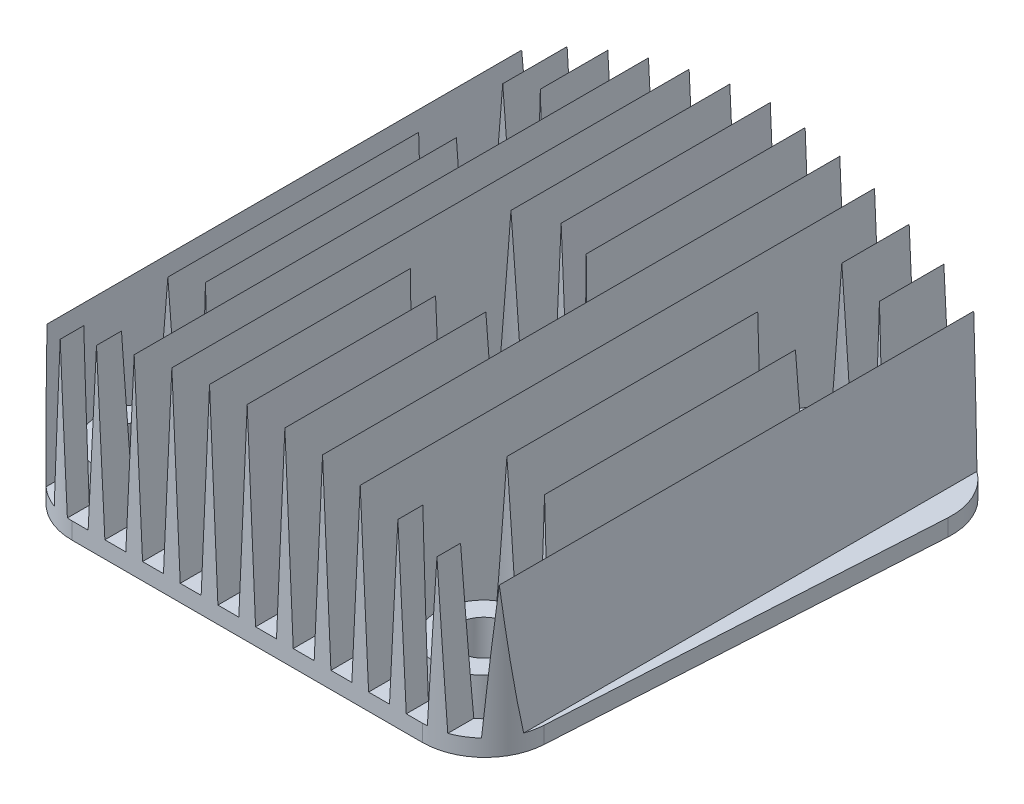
SolidWorks part; units mm, degrees
ref_plane "Front Plane" through (0, 0, 0) normal (0, 0, 1) x (1, 0, 0)
ref_plane "Top Plane" through (0, 0, 0) normal (0, 1, 0) x (1, 0, 0)
ref_plane "Right Plane" through (0, 0, 0) normal (1, 0, 0) x (0, 0, -1)
sketch "Sketch1" plane through (0, 0, 0) normal (0, 1, 0) x (1, 0, 0)
  line L0 (-56, -60) -> (56, -60)
  line L1 (56, -60) -> (63, 60)
  line L2 (63, 60) -> (0, 65)
  line L3 (0, 65) -> (-63, 60)
  line L4 (-63, 60) -> (-56, -60)
  line L5 (0, -60) -> (0, 65) construction
  dimension "D1" = 112
  dimension "D2" = 60
  dimension "D3" = 126
  dimension "D4" = 125
  dimension "D5" = 60
extrude "Boss-Extrude1" add sketch "Sketch1" along normal blind 4
fillet "Fillet1" radius 15 5 edges at (-63, 2, -60) (0, 2, -65) (63, 2, -60) (-56, 2, 60) (56, 2, 60)
sketch "Sketch2" plane through (0, 0, 0) normal (0, -1, 0) x (1, 0, 0)
  circle A0 centre (0, 0) radius 27.5
  dimension "D1" = 55
extrude "Boss-Extrude2" add sketch "Sketch2" along normal blind 4
sketch "Sketch3" plane through (0, 0, 0) normal (0, 0, 1) x (1, 0, 0)
  line L0 (0, 10.5114) -> (0, -9.5692) construction
  line L1 (0, 1.7356) -> (0, -4)
  line L2 (0, -4) -> (22.5, -4)
  line L3 (-27.5, -4) -> (27.5, -4) construction
  arc A0 (0, 1.7356) -> (22.5, -4) centre (0, -45.2644) cw
  dimension "D2" = 47
  dimension "D1" = 45
revolve "Cut-Revolve1" cut sketch "Sketch3" angle 360 about L0
sketch "Sketch4" plane through (0, 0, 0) normal (0, 0, 1) x (1, 0, 0)
  line L0 (-55.9896, 4) -> (-51.9896, 4)
  line L1 (-41.8495, 4) -> (-56.824, 4) construction
  line L2 (-51.9896, 4) -> (-53.9896, 35.5388)
  line L3 (-53.9896, 35.5388) -> (-55.9896, 4)
  line L4 (-53.9896, 4) -> (-53.9896, 35.5388) construction
  line L5 (-62.1446, 4) -> (-62.1446, 0) construction
  line L6 (-27.5, -4) -> (27.5, -4) construction
  arc A0 (-97.7909, -5.486) -> (96.5859, -3.5808) centre (0, -66) cw construction
  dimension "D1" = 115
  dimension "D2" = 4
  dimension "D3" = 6.155
  dimension "D4" = 62
extrude "Boss-Extrude3" add sketch "Sketch4" along normal mid plane 130
pattern_linear "LPattern1" count 13 spacing 9 of "Boss-Extrude3"
sketch "Sketch5" plane through (0, 0, 0) normal (0, -1, 0) x (1, 0, 0)
  line L5 (-56.824, 45.8735) -> (-62.1446, -45.3357)
  line L6 (-48.3568, -61.1622) -> (-1.1867, -64.9058)
  line L7 (1.1867, -64.9058) -> (48.3568, -61.1622)
  line L8 (62.1446, -45.3357) -> (56.824, 45.8735)
  line L9 (41.8495, 60) -> (-41.8495, 60)
  line L10 (-56.824, 45.8735) -> (-62.1446, -45.3357)
  line L11 (-48.3568, -61.1622) -> (-1.1867, -64.9058)
  line L12 (1.1867, -64.9058) -> (48.3568, -61.1622)
  line L13 (62.1446, -45.3357) -> (56.824, 45.8735)
  line L14 (41.8495, 60) -> (-41.8495, 60)
  arc A5 (-62.1446, -45.3357) -> (-48.3568, -61.1622) centre (-47.17, -46.2092) ccw
  arc A6 (-1.1867, -64.9058) -> (1.1867, -64.9058) centre (0, -49.9528) ccw
  arc A7 (48.3568, -61.1622) -> (62.1446, -45.3357) centre (47.17, -46.2092) ccw
  arc A8 (56.824, 45.8735) -> (41.8495, 60) centre (41.8495, 45) ccw
  arc A9 (-41.8495, 60) -> (-56.824, 45.8735) centre (-41.8495, 45) ccw
  arc A10 (-62.1446, -45.3357) -> (-48.3568, -61.1622) centre (-47.17, -46.2092) ccw
  arc A11 (-1.1867, -64.9058) -> (1.1867, -64.9058) centre (0, -49.9528) ccw
  arc A12 (48.3568, -61.1622) -> (62.1446, -45.3357) centre (47.17, -46.2092) ccw
  arc A13 (56.824, 45.8735) -> (41.8495, 60) centre (41.8495, 45) ccw
  arc A14 (-41.8495, 60) -> (-56.824, 45.8735) centre (-41.8495, 45) ccw
  dimension "D1" = 0
extrude "Cut-Extrude1" cut sketch "Sketch5" against normal blind 130 flip side to cut
sketch "Sketch6" plane through (0, 4, 0) normal (0, 1, 0) x (1, 0, 0)
  line L0 (-33.9896, -60) -> (-28.9896, -60) construction
  circle A0 centre (-40.5, -44) radius 11
  dimension "D2" = 40.5
  dimension "D4" = 22
  dimension "D1" = 16
extrude "Cut-Extrude2" cut sketch "Sketch6" along normal blind 130
sketch "Sketch7" plane through (0, 4, 0) normal (0, 1, 0) x (1, 0, 0)
  circle A0 centre (-40.5, -44) radius 11
  arc A1 (-42.9896, -33.2854) -> (-46.9896, -35.1183) centre (-40.5, -44) ccw construction
extrude "Boss-Extrude4" add sketch "Sketch7" along normal blind 9
sketch "Sketch9" plane through (0, 4, 0) normal (0, 1, 0) x (1, 0, 0)
  circle A0 centre (0, 0) radius 15
  dimension "D1" = 30
extrude "Cut-Extrude4" cut sketch "Sketch9" along normal blind 92
sketch "Sketch10" plane through (0, 4, 0) normal (0, 1, 0) x (1, 0, 0)
  circle A0 centre (0, 0) radius 15
  arc A1 (-6.9896, 13.272) -> (-10.9896, 10.2093) centre (0, 0) ccw construction
extrude "Boss-Extrude5" add sketch "Sketch10" along normal blind 9
sketch "Sketch8" plane through (0, 13, 0) normal (0, 1, 0) x (1, 0, 0)
  circle A0 centre (-40.5, -44) radius 6
  dimension "D1" = 12
extrude "Cut-Extrude3" cut sketch "Sketch8" against normal up to surface (9 mm away)
pattern_linear "LPattern2" count 2 spacing 81 along (1, 0, 0) count 2 spacing 80 along (0, 0, -1) of "Cut-Extrude2", "Boss-Extrude4", "Cut-Extrude3"
hole_wizard "M18x1.5 Tapped Hole1" positions "Sketch12" profile "Sketch11" tap size "M18x1.5" standard "Ansi Metric"
sketch "Sketch12" plane through (0, 13, 0) normal (0, 1, 0) x (-1, 0, 0)
  arc A0 (10.5864, -10.6267) -> (10.5864, 10.6267) centre (0, 0) ccw construction
  point P0 (0, 0)
sketch "Sketch11" plane through (0, 13, 0) normal (1, 0, 0) x (0, 0, 1)
  line L0 (0, 0) -> (0, 17)
  line L1 (0, 17) -> (8.25, 17)
  line L2 (8.25, 17) -> (8.25, 0)
  line L5 (8.25, 0) -> (0, 0)
  line L11 (0, -6.35) -> (0, 107.95) construction
  dimension "Thru Tap Drill Dia." = 16.5
  dimension "Thru Tap Drill Depth" = 17
